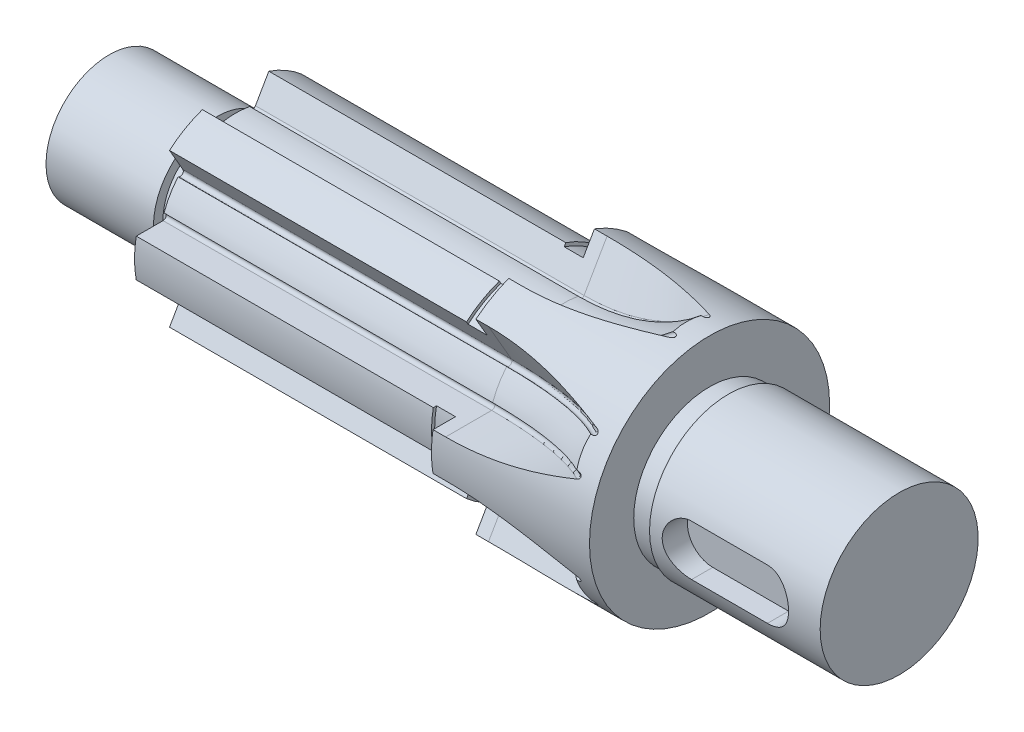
SolidWorks part; units mm, degrees
ref_plane "前视基准面" through (0, 0, 0) normal (0, 0, 1) x (1, 0, 0)
ref_plane "上视基准面" through (0, 0, 0) normal (0, 1, 0) x (1, 0, 0)
ref_plane "右视基准面" through (0, 0, 0) normal (1, 0, 0) x (0, 0, -1)
sketch "草图1" plane through (0, 0, 0) normal (0, 0, 1) x (1, 0, 0)
  line L0 (0, 0) -> (0, 10)
  line L1 (0, 10) -> (17, 10)
  line L2 (17, 10) -> (17, 8.5)
  line L3 (20, 16) -> (67, 16)
  line L4 (95, 19) -> (95, 12)
  line L5 (95, 12) -> (98, 12)
  line L6 (125, 12.5) -> (125, 0)
  line L7 (17, 8.5) -> (20, 8.5)
  line L8 (67, 16) -> (67, 15.5)
  line L9 (70, 19) -> (95, 19)
  line L10 (0, 0) -> (125, 0)
  line L11 (20, 8.5) -> (20, 16)
  line L12 (67, 15.5) -> (70, 15.5)
  line L13 (70, 15.5) -> (70, 19)
  line L14 (98, 12) -> (98, 12.5)
  line L15 (98, 12.5) -> (125, 12.5)
  dimension "D1" = 10
  dimension "D2" = 20
  dimension "D3" = 50
  dimension "D4" = 125
  dimension "D5" = 30
  dimension "D6" = 16
  dimension "D7" = 19
  dimension "D8" = 12.5
  dimension "D9" = 3
  dimension "D10" = 1.5
  dimension "D11" = 3
  dimension "D12" = 0.5
  dimension "D13" = 3
  dimension "D14" = 0.5
revolve "旋转1" add sketch "草图1" angle 360 about L10
ref_plane "基准面1" through (0, 0, 12.5) normal (0, 0, 1) x (1, 0, 0)
sketch "草图2" plane through (0, 0, 12.5) normal (0, 0, 1) x (1, 0, 0)
  line L0 (104, 0) -> (116, 0) construction
  line L1 (104, 4) -> (116, 4)
  line L2 (104, -4) -> (116, -4)
  line L5 (95, -19) -> (95, 19) construction
  arc A0 (104, 4) -> (104, -4) centre (104, 0) ccw
  arc A1 (116, -4) -> (116, 4) centre (116, 0) ccw
  point P2 (110, 0)
  dimension "D1" = 8
  dimension "D2" = 9
  dimension "D3" = 12
extrude "切除-拉伸1" cut sketch "草图2" against normal blind 4 contours L2 A1 L1 A0
sketch "草图5" plane through (20, 0, 0) normal (-1, 0, 0) x (0, 0, 1)
  line L0 (0, 0) -> (0, 28) construction
  line L1 (0, 0) -> (14, 24.2487) construction
  line L2 (0, 0) -> (-14, 24.2487) construction
  line L3 (-3.141, 11.4404) -> (-8, 19.8564)
  line L4 (-8, 19.8564) -> (-8, 20.8564)
  line L5 (-8, 20.8564) -> (8, 20.8564)
  line L6 (3.141, 11.4404) -> (8, 19.8564)
  line L7 (8, 19.8564) -> (8, 20.8564)
  arc A0 (-2.2187, 11.7931) -> (2.2187, 11.7931) centre (0, 0) cw
  arc A1 (-2.2187, 11.7931) -> (-3.141, 11.4404) centre (-2.708, 11.6904) cw
  circle A2 centre (0, 0) radius 11.5 construction
  arc A3 (2.2187, 11.7931) -> (3.141, 11.4404) centre (2.708, 11.6904) ccw
  point P17 (0, 20.8564)
  dimension "D4" = 12
  dimension "D6" = 0.5
  dimension "D7" = 23
  dimension "D1" = 30
  dimension "D2" = 30
  dimension "D3" = 8
  dimension "D5" = 3
  dimension "D8" = 1
sketch "草图7" plane through (0, 0, 0) normal (0, 0, 1) x (1, 0, 0)
  line L0 (20, 12) -> (72, 12)
  arc A0 (72, 12) -> (101.4691, 36.3813) centre (72, 42) ccw
  dimension "D2" = 30
  dimension "D1" = 52
sweep "切除-扫描1" cut profiles "草图5" path "草图7"
pattern_circular "阵列(圆周)1" count 6 over 360 about axis through (0, 0, 0) along (1, 0, 0) of "切除-扫描1"
